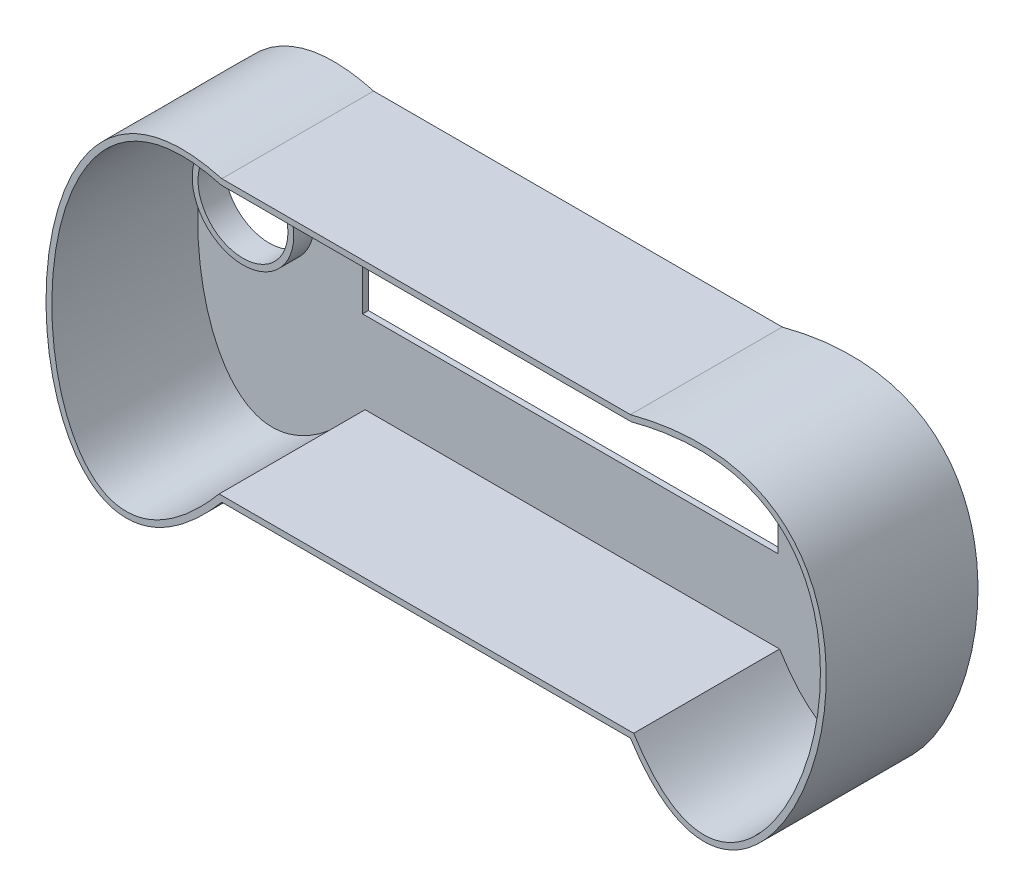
SolidWorks part; units mm, degrees
ref_plane "Plan de face" through (0, 0, 0) normal (0, 0, 1) x (1, 0, 0)
ref_plane "Plan de dessus" through (0, 0, 0) normal (0, 1, 0) x (1, 0, 0)
ref_plane "Plan de droite" through (0, 0, 0) normal (1, 0, 0) x (0, 0, -1)
sketch "Esquisse1" plane through (0, 0, 0) normal (0, 0, 1) x (1, 0, 0)
  line L0 (70, 60) -> (70, 0) construction
  line L1 (0, 0) -> (140, 0) construction
  line L2 (0, 0) -> (0, 60) construction
  line L3 (0, 60) -> (140, 60) construction
  line L4 (140, 0) -> (140, 60) construction
  line L5 (35, 60) -> (35, 0) construction
  line L6 (105.5496, 11.5971) -> (34.5386, 11.5971)
  line L7 (105, 60) -> (105, 0) construction
  line L8 (105, 58.5971) -> (35, 58.5971)
  line L9 (140, 30) -> (0, 30) construction
  line L10 (105, 10.5971) -> (35, 10.5971)
  line L11 (105.129, 57.5971) -> (34.8641, 57.5971)
  spline S0 degree 3 poles (35, 58.5971) (-8.5276, 70.6528) (-1.6777, -32.3974) (35, 10.5971) knots 0 0 0 0 1 1 1 1
  spline S1 degree 3 poles (105, 58.5971) (165.9164, 74.5859) (130.0804, -28.9014) (105, 10.5971) knots 0 0 0 0 1 1 1 1
  spline S2 degree 1 poles (34.8641, 57.5971) (34.5386, 11.5971) knots 0 0 1 1 construction
  spline S3 degree 1 poles (105.129, 57.5971) (105.5496, 11.5971) knots 0 0 1 1 construction
  spline S4 degree 3 poles (34.8641, 57.5971) (34.5359, 57.688) (33.8696, 57.8654) (32.5895, 58.1539) (31.0302, 58.4185) (29.2413, 58.5814) (26.9578, 58.6048) (24.2921, 58.2868) (20.4054, 57.1062) (16.2062, 54.4795) (12.1481, 49.7855) (9.0784, 43.8885) (7.0017, 37.1737) (5.907, 30.0382) (5.7716, 22.8816) (6.5648, 16.105) (8.2452, 10.1138) (10.7508, 5.3161) (13.9656, 2.1151) (17.1238, 0.9689) (20.0503, 1.061) (22.4837, 1.7087) (25.1585, 3.0094) (27.579, 4.6929) (29.623, 6.4282) (31.2071, 7.9287) (32.5718, 9.3554) (33.6822, 10.594) (34.2561, 11.2659) (34.5386, 11.5971) knots -0.001003 -0.001003 -0.001003 -0.001003 0.006838 0.01468 0.030363 0.046046 0.06173 0.093096 0.124462 0.187195 0.249928 0.312661 0.375393 0.438126 0.500859 0.563592 0.626325 0.689057 0.75179 0.814523 0.845889 0.877256 0.908622 0.939988 0.955672 0.971355 0.987038 0.99488 1.002721 1.002721 1.002721 1.002721
  spline S5 degree 3 poles (105.5496, 11.5971) (105.7429, 11.2927) (106.135, 10.6717) (106.9006, 9.544) (107.8691, 8.251) (109.031, 6.9095) (110.5796, 5.381) (112.5013, 3.9443) (114.7592, 2.9061) (116.9644, 2.4752) (119.8593, 2.6257) (123.4455, 4.0922) (127.5539, 7.6881) (131.2129, 12.7696) (134.2209, 18.9366) (136.3986, 25.7851) (137.581, 32.9102) (137.6129, 39.9052) (136.3536, 46.3629) (133.6866, 51.8869) (130.2011, 55.4347) (126.5506, 57.5001) (123.3435, 58.6193) (119.6334, 59.257) (116.0989, 59.3401) (112.994, 59.1087) (110.5258, 58.7799) (108.346, 58.369) (106.5379, 57.9587) (105.5942, 57.7192) (105.129, 57.5971) knots -0.000683 -0.000683 -0.000683 -0.000683 0.007165 0.015014 0.030711 0.046408 0.062104 0.093498 0.124892 0.156285 0.187679 0.250467 0.313254 0.376041 0.438829 0.501616 0.564404 0.627191 0.689978 0.752766 0.815553 0.846947 0.878341 0.909734 0.941128 0.956825 0.972522 0.988219 0.996067 1.003915 1.003915 1.003915 1.003915
  dimension "D1" = 140
  dimension "D2" = 60
  dimension "D3" = 35
  dimension "D4" = 35
  dimension "D5" = 1
extrude "Boss.-Extru.1" add sketch "Esquisse1" along normal blind 25
sketch "Esquisse2" plane through (0, 0, 0) normal (0, 0, -1) x (-1, 0, 0)
  line L2 (-35, 58.5971) -> (-105, 58.5971)
  line L3 (-105, 10.5971) -> (-35, 10.5971)
  line L4 (-35, 58.5971) -> (-105, 58.5971)
  line L5 (-105, 10.5971) -> (-35, 10.5971)
  spline S2 degree 3 poles (-442.8994, 3982.8599) (-68.3512, -4266.2173) (578.7991, 4272.8138) (-1127.9096, -3778.0147) knots -1.974326 -1.974326 -1.974326 -1.974326 3.062879 3.062879 3.062879 3.062879 only from (-35, 10.5971) to (-35, 58.5971)
  spline S3 degree 3 poles (2105.9778, -3263.2805) (-1992.2407, 3879.9703) (1227.6887, -4036.6874) (-905.6527, 3921.7945) knots -1.931681 -1.931681 -1.931681 -1.931681 2.971316 2.971316 2.971316 2.971316 only from (-105, 58.5971) to (-105, 10.5971)
  spline S4 degree 3 poles (-35, 10.5971) (1.6777, -32.3974) (8.5276, 70.6528) (-35, 58.5971) knots 0 0 0 0 1 1 1 1
  spline S5 degree 3 poles (-105, 58.5971) (-165.9164, 74.5859) (-130.0804, -28.9014) (-105, 10.5971) knots 0 0 0 0 1 1 1 1
  dimension "D1" = 0
extrude "Boss.-Extru.2" add sketch "Esquisse2" along normal blind 1
sketch "Esquisse3" plane through (0, 0, -1) normal (0, 0, -1) x (-1, 0, 0)
  line L0 (-105, 10.5971) -> (-35, 10.5971) construction
  line L1 (-105.3147, 49.7971) -> (-34.1147, 49.7971)
  line L2 (-105.3147, 49.7971) -> (-105.3147, 25.5971)
  line L3 (-105.3147, 25.5971) -> (-34.1147, 25.5971)
  line L4 (-34.1147, 49.7971) -> (-34.1147, 25.5971)
  circle A0 centre (-122.3147, 34.7971) radius 7.7
  circle A1 centre (-17.1147, 34.7971) radius 7.7
  dimension "D3" = 15.4
  dimension "D4" = 15.4
  dimension "D1" = 71.2
  dimension "D2" = 24.2
  dimension "D5" = 15
  dimension "D6" = 15
  dimension "D7" = 15
  dimension "D8" = 17
  dimension "D9" = 17
extrude "Enlèv. mat.-Extru.1" cut sketch "Esquisse3" against normal blind 1
sketch "Esquisse4" plane through (0, 0, 0) normal (0, 0, 1) x (1, 0, 0)
  circle A0 centre (17.1147, 34.7971) radius 7.7
  circle A1 centre (122.3147, 34.7971) radius 7.7
  circle A2 centre (17.1147, 34.7971) radius 8.7
  circle A3 centre (122.3147, 34.7971) radius 8.7
  dimension "D1" = 15.4
  dimension "D2" = 15.4
  dimension "D3" = 1
extrude "Boss.-Extru.3" add sketch "Esquisse4" along normal blind 3.5
